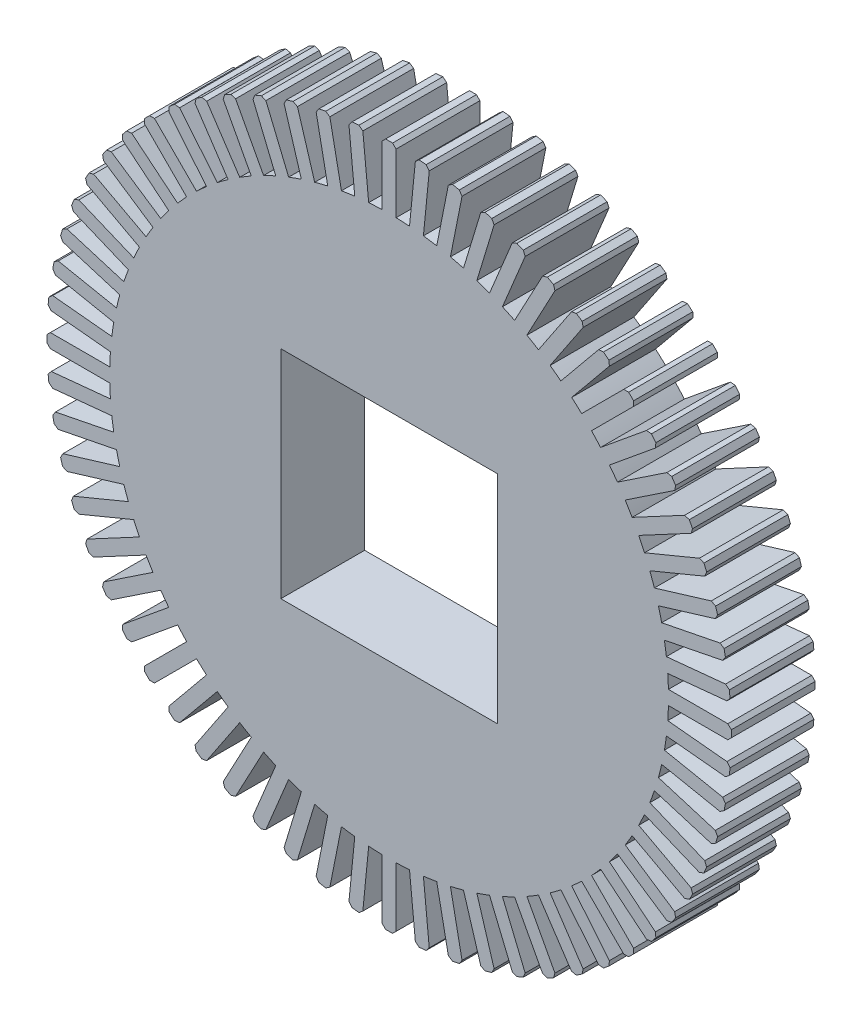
SolidWorks part; units mm, degrees
ref_plane "Front Plane" through (0, 0, 0) normal (0, 0, 1) x (1, 0, 0)
ref_plane "Top Plane" through (0, 0, 0) normal (0, 1, 0) x (1, 0, 0)
ref_plane "Right Plane" through (0, 0, 0) normal (1, 0, 0) x (0, 0, -1)
sketch "Sketch1" plane through (0, 0, 0) normal (0, 0, 1) x (1, 0, 0)
  circle A0 centre (0, 0) radius 20
  dimension "D1" = 40
extrude "Boss-Extrude1" add sketch "Sketch1" along normal blind 6 contours A0
sketch "Sketch2" plane through (0, 0, 6) normal (0, 0, 1) x (1, 0, 0)
  line L0 (0, 20) -> (0, 24.5)
  line L1 (0.25, 24.5) -> (-0.25, 24.5)
  line L2 (-0.25, 24.5) -> (-0.5, 24.25)
  line L3 (-0.5, 24.25) -> (-0.5, 19.9937)
  line L4 (0.5, 24.25) -> (0.5, 19.9937)
  line L5 (0.25, 24.5) -> (0.5, 24.25)
  circle A0 centre (0, 0) radius 20 construction
  dimension "D1" = 4.5
  dimension "D2" = 0.5
  dimension "D3" = 45
  dimension "D4" = 0.25
extrude "Boss-Extrude2" add sketch "Sketch2" against normal up to surface (6 mm away) contours L2 L3 L0 L1 M5 | L5 L1 L0 L4 M5
pattern_circular "CirPattern1" count 64 over 360 about axis through (0, 0, 0) along (0, 0, 1) of "Boss-Extrude2"
sketch "Sketch3" plane through (0, 0, 6) normal (0, 0, 1) x (1, 0, 0)
  line L1 (-7.75, 7.75) -> (7.75, 7.75)
  line L2 (-7.75, 7.75) -> (-7.75, -7.75)
  line L3 (-7.75, -7.75) -> (7.75, -7.75)
  line L4 (7.75, 7.75) -> (7.75, -7.75)
  point P4 (0, 7.75)
  point P6 (-7.75, 0)
  dimension "D1" = 15.5
  dimension "D2" = 15.5
extrude "Cut-Extrude1" cut sketch "Sketch3" against normal up to surface (6 mm away)
